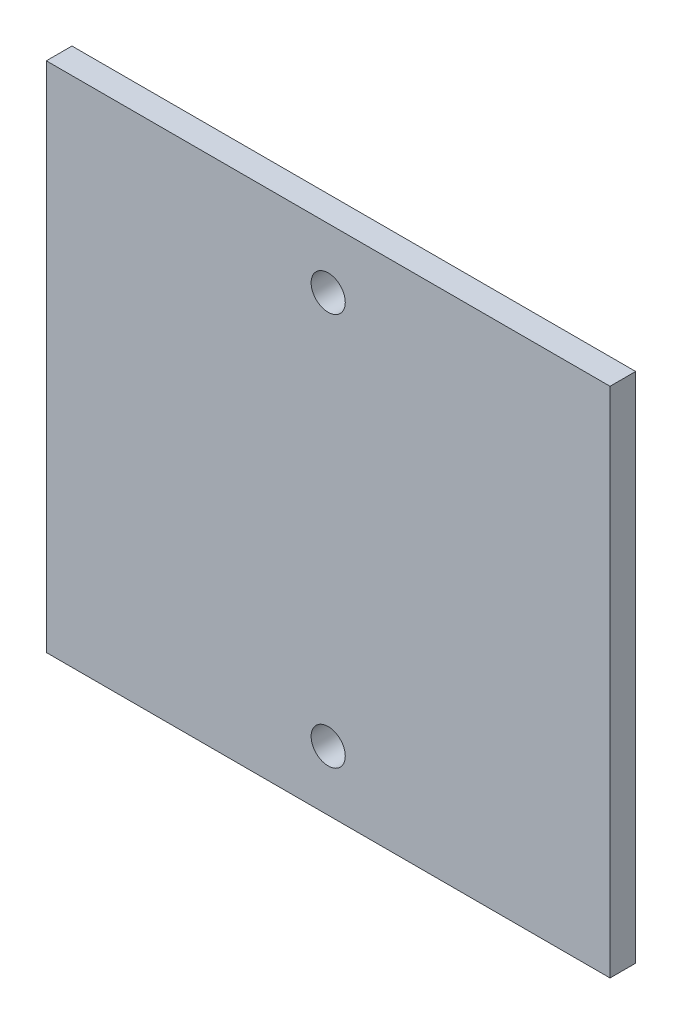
SolidWorks part; units mm, degrees
ref_plane "Plan de face" through (0, 0, 0) normal (0, 0, 1) x (1, 0, 0)
ref_plane "Plan de dessus" through (0, 0, 0) normal (0, 1, 0) x (1, 0, 0)
ref_plane "Plan de droite" through (0, 0, 0) normal (1, 0, 0) x (0, 0, -1)
sketch "Esquisse1" plane through (0, 0, 0) normal (0, 0, 1) x (1, 0, 0)
  line L1 (-165, -150) -> (165, -150)
  line L2 (-165, -150) -> (-165, 150)
  line L3 (-165, 150) -> (165, 150)
  line L4 (165, -150) -> (165, 150)
  line L5 (-165, -150) -> (165, 150) construction
  line L6 (-165, 150) -> (165, -150) construction
  point P0 (0, 0)
  dimension "D1" = 165
  dimension "D2" = 150
extrude "Boss.-Extru.1" add sketch "Esquisse1" along normal blind 15
sketch "Esquisse2" plane through (0, 0, 15) normal (0, 0, 1) x (1, 0, 0)
  line L0 (-165, 150) -> (-165, -150) construction
  line L1 (-165, -150) -> (165, -150) construction
  line L2 (165, 150) -> (-165, 150) construction
  circle A0 centre (0, 115) radius 10
  circle A1 centre (0, -115) radius 10
  dimension "D1" = 20
  dimension "D2" = 20
  dimension "D3" = 165
  dimension "D4" = 35
  dimension "D5" = 165
  dimension "D6" = 35
extrude "Enlèv. mat.-Extru.1" cut sketch "Esquisse2" against normal through all
